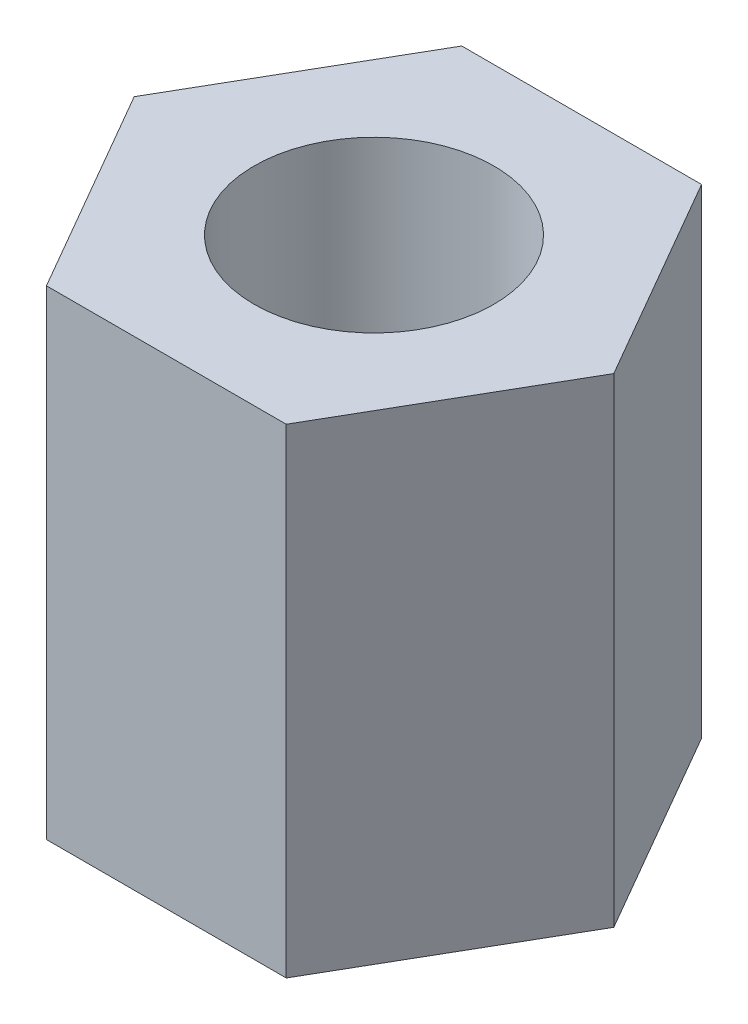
SolidWorks part; units mm, degrees
ref_plane "Front" through (0, 0, 0) normal (0, 0, 1) x (1, 0, 0)
ref_plane "Top" through (0, 0, 0) normal (0, 1, 0) x (1, 0, 0)
ref_plane "Right" through (0, 0, 0) normal (1, 0, 0) x (0, 0, -1)
sketch "Sketch1" plane through (0, 0, 0) normal (0, 1, 0) x (1, 0, 0)
  line L1 (4, 0) -> (2, 3.4641)
  line L2 (2, 3.4641) -> (-2, 3.4641)
  line L3 (-2, 3.4641) -> (-4, 0)
  line L4 (-4, 0) -> (-2, -3.4641)
  line L5 (-2, -3.4641) -> (2, -3.4641)
  line L6 (2, -3.4641) -> (4, 0)
  circle A0 centre (0, 0) radius 3.4641 construction
  circle A1 centre (0, 0) radius 2
  dimension "D1" = 4
  dimension "D2" = 4
extrude "Extrude1" add sketch "Sketch1" along normal blind 8
